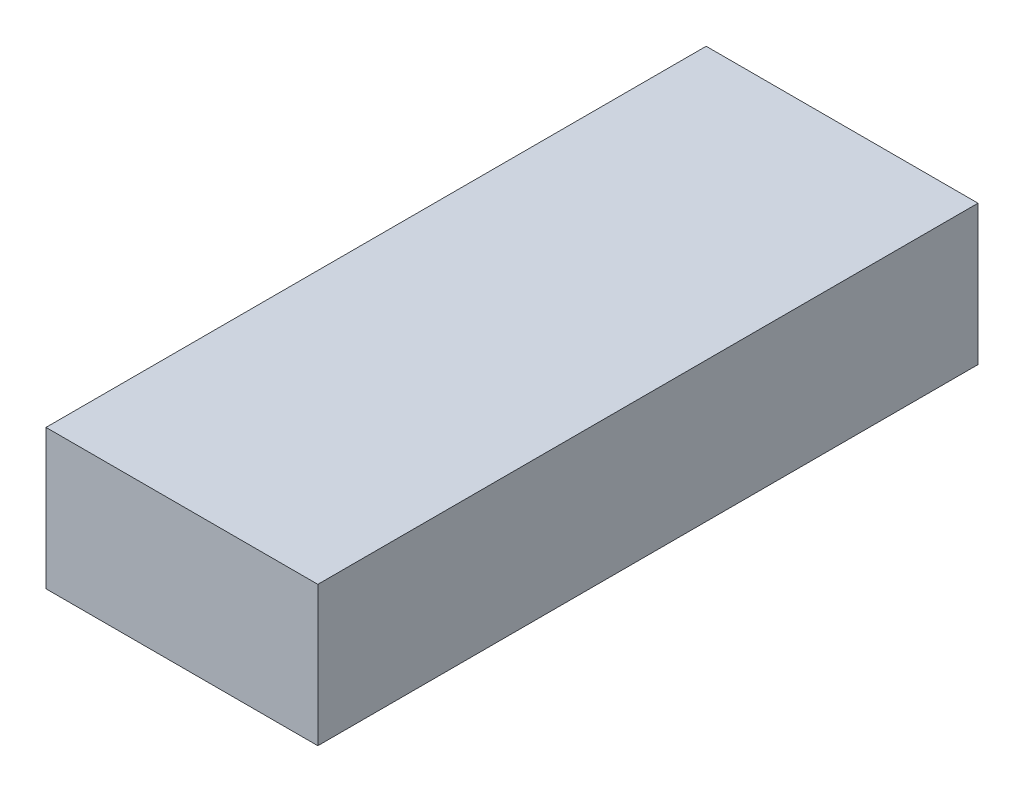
SolidWorks part; units mm, degrees
ref_plane "Front Plane" through (0, 0, 0) normal (0, 0, 1) x (1, 0, 0)
ref_plane "Top Plane" through (0, 0, 0) normal (0, 1, 0) x (1, 0, 0)
ref_plane "Right Plane" through (0, 0, 0) normal (1, 0, 0) x (0, 0, -1)
sketch "Sketch1" plane through (0, 0, 0) normal (0, 1, 0) x (1, 0, 0)
  line L1 (-17.5, 42.5) -> (17.5, 42.5)
  line L2 (-17.5, 42.5) -> (-17.5, -42.5)
  line L3 (-17.5, -42.5) -> (17.5, -42.5)
  line L4 (17.5, 42.5) -> (17.5, -42.5)
  line L5 (-17.5, 42.5) -> (17.5, -42.5) construction
  line L6 (-17.5, -42.5) -> (17.5, 42.5) construction
  point P0 (0, 0)
  dimension "D1" = 35
  dimension "D2" = 85
extrude "Boss-Extrude1" add sketch "Sketch1" along normal blind 18
